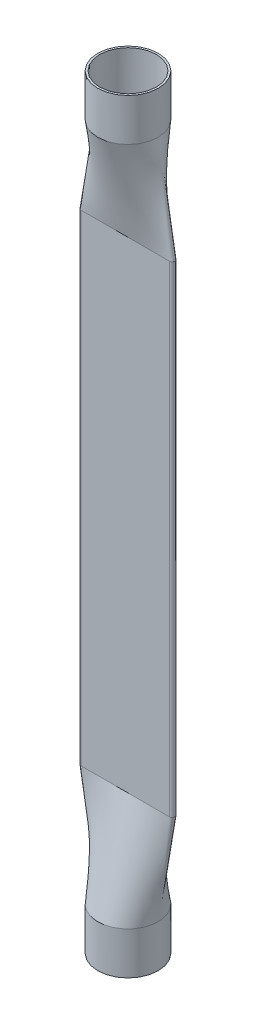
SolidWorks part; units mm, degrees
ref_plane "Front Plane" through (0, 0, 0) normal (0, 0, 1) x (1, 0, 0)
ref_plane "Top Plane" through (0, 0, 0) normal (0, 1, 0) x (1, 0, 0)
ref_plane "Right Plane" through (0, 0, 0) normal (1, 0, 0) x (0, 0, -1)
sketch "Sketch1" plane through (0, 0, 0) normal (0, 1, 0) x (1, 0, 0)
  circle A0 centre (0, 0) radius 25.4
  circle A1 centre (0, 0) radius 27.2034
  dimension "D1" = 1.8034
  dimension "D2" = 50.8
extrude "Boss-Extrude1" add sketch "Sketch1" along normal blind 38.1
sketch "Sketch2" plane through (0, 38.1, 0) normal (0, 1, 0) x (1, 0, 0)
  circle A0 centre (0, 0) radius 27.2034
  circle A2 centre (0, 0) radius 27.2034 construction
  point P2 (0, -27.2034)
ref_plane "Plane1" through (0, 127, 0) normal (0, 1, 0) x (1, 0, 0)
sketch "Sketch3" plane through (0, 127, 0) normal (0, 1, 0) x (1, 0, 0)
  line L0 (39.6304, 0) -> (-39.6304, 0) construction
  line L1 (39.6304, -2.4384) -> (-39.6304, -2.4384)
  line L2 (39.6304, 2.4384) -> (-39.6304, 2.4384)
  arc A0 (39.6304, -2.4384) -> (39.6304, 2.4384) centre (39.6304, 0) ccw
  arc A3 (-39.6304, 2.4384) -> (-39.6304, -2.4384) centre (-39.6304, 0) ccw
  point P2 (0, 0)
  dimension "D2" = 84.1375
  dimension "D1" = 4.8768
loft "Loft5" add profiles "Sketch2", "Sketch3"
sketch "Sketch6" plane through (0, 127, 0) normal (0, 1, 0) x (1, 0, 0)
  line L4 (-39.6304, -0.635) -> (39.6304, -0.635)
  line L5 (39.6304, 0.635) -> (-39.6304, 0.635)
  line L6 (-39.6304, -0.635) -> (39.6304, -0.635)
  line L7 (39.6304, 0.635) -> (-39.6304, 0.635)
  arc A4 (-39.6304, 0.635) -> (-39.6304, -0.635) centre (-39.6304, 0) ccw
  arc A5 (39.6304, -0.635) -> (39.6304, 0.635) centre (39.6304, 0) ccw
  arc A6 (-39.6304, 0.635) -> (-39.6304, -0.635) centre (-39.6304, 0) ccw
  arc A7 (39.6304, -0.635) -> (39.6304, 0.635) centre (39.6304, 0) ccw
  dimension "D1" = 1.8034
ref_plane "Plane3" through (0, 38.1, 0) normal (0, 1, 0) x (1, 0, 0)
sketch "Sketch7" plane through (0, 38.1, 0) normal (0, 1, 0) x (1, 0, 0)
  circle A0 centre (0, 0) radius 25.4
  circle A1 centre (0, 0) radius 25.4 construction
loft "Cut-Loft1" cut profiles "Sketch7", "Sketch6"
sketch "Sketch8" plane through (0, 127, 0) normal (0, 1, 0) x (1, 0, 0)
  line L4 (39.6303, 2.4384) -> (-39.6304, 2.4384)
  line L5 (-39.6304, -2.4384) -> (39.6304, -2.4384)
  line L6 (39.6303, 2.4384) -> (-39.6304, 2.4384)
  line L7 (-39.6304, -2.4384) -> (39.6304, -2.4384)
  line L14 (-39.6303, -0.635) -> (39.6304, -0.635)
  line L15 (39.6304, 0.635) -> (-39.6304, 0.635)
  line L16 (-39.6303, -0.635) -> (39.6304, -0.635)
  line L17 (39.6304, 0.635) -> (-39.6304, 0.635)
  arc A4 (39.6304, -2.4384) -> (39.6303, 2.4384) centre (39.6304, 0) ccw
  arc A5 (-39.6304, 2.4384) -> (-39.6304, -2.4384) centre (-39.6304, 0) ccw
  arc A6 (39.6304, -2.4384) -> (39.6303, 2.4384) centre (39.6304, 0) ccw
  arc A7 (-39.6304, 2.4384) -> (-39.6304, -2.4384) centre (-39.6304, 0) ccw
  arc A9 (-39.6304, 0.635) -> (-39.6303, -0.635) centre (-39.6304, 0) ccw
  arc A10 (-39.6304, 0.635) -> (-39.6303, -0.635) centre (-39.6304, 0) ccw
  dimension "D1" = 0
  dimension "D2" = 0
extrude "Boss-Extrude2" add sketch "Sketch8" along normal offset from surface (215.9 mm away) 342.9
ref_plane "Plane4" through (0, 342.9, 0) normal (0, 1, 0) x (1, 0, 0)
mirror "Mirror6" about plane through (0, 342.9, 0) normal (0, 1, 0) of "Boss-Extrude2"
mirror "Mirror7" about plane through (0, 342.9, 0) normal (0, 1, 0) of "Loft5", "Cut-Loft1"
mirror "Mirror8" about plane through (0, 342.9, 0) normal (0, 1, 0) of "Boss-Extrude1"
